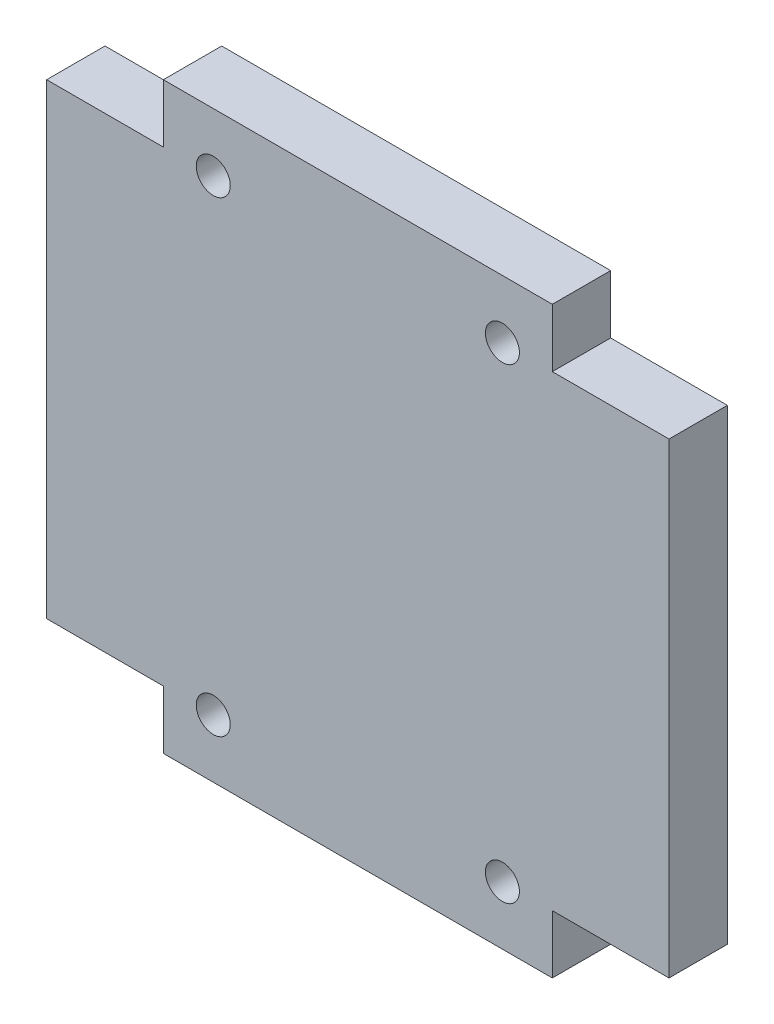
SolidWorks part; units mm, degrees
ref_plane "Front Plane" through (0, 0, 0) normal (0, 0, 1) x (1, 0, 0)
ref_plane "Top Plane" through (0, 0, 0) normal (0, 1, 0) x (1, 0, 0)
ref_plane "Right Plane" through (0, 0, 0) normal (1, 0, 0) x (0, 0, -1)
sketch "Sketch1" plane through (0, 0, 0) normal (0, 0, 1) x (1, 0, 0)
  line L0 (-211.3422, -271.0287) -> (-217.3422, -271.0287)
  line L1 (-217.3422, -271.0287) -> (-217.3422, -268.0287)
  line L2 (-217.3422, -268.0287) -> (-237.3422, -268.0287)
  line L3 (-237.3422, -268.0287) -> (-237.3422, -271.0287)
  line L4 (-237.3422, -271.0287) -> (-243.3422, -271.0287)
  line L5 (-243.3422, -271.0287) -> (-243.3422, -295.0287)
  line L6 (-243.3422, -295.0287) -> (-237.3422, -295.0287)
  line L7 (-237.3422, -295.0287) -> (-237.3422, -298.0287)
  line L8 (-237.3422, -298.0287) -> (-217.3422, -298.0287)
  line L9 (-217.3422, -298.0287) -> (-217.3422, -295.0287)
  line L10 (-217.3422, -295.0287) -> (-211.3422, -295.0287)
  line L11 (-211.3422, -295.0287) -> (-211.3422, -271.0287)
extrude "Boss-Extrude1" add sketch "Sketch1" along normal blind 3
sketch "Sketch2" plane through (0, 0, 3) normal (0, 0, 1) x (1, 0, 0)
  line L1 (-234.7759, -295.0287) -> (-219.9084, -295.0287) construction
  line L2 (-234.7759, -295.0287) -> (-234.7759, -271.0287) construction
  line L3 (-234.7759, -271.0287) -> (-219.9084, -271.0287) construction
  line L4 (-219.9084, -295.0287) -> (-219.9084, -271.0287) construction
  line L5 (-234.7759, -295.0287) -> (-219.9084, -271.0287) construction
  line L6 (-234.7759, -271.0287) -> (-219.9084, -295.0287) construction
  circle A0 centre (-219.9084, -271.0287) radius 0.875
  circle A1 centre (-219.9084, -295.0287) radius 0.875
  circle A2 centre (-234.7759, -271.0287) radius 0.875
  circle A3 centre (-234.7759, -295.0287) radius 0.875
  point P0 (-227.3422, -283.0287)
extrude "Cut-Extrude1" cut sketch "Sketch2" against normal blind 3
